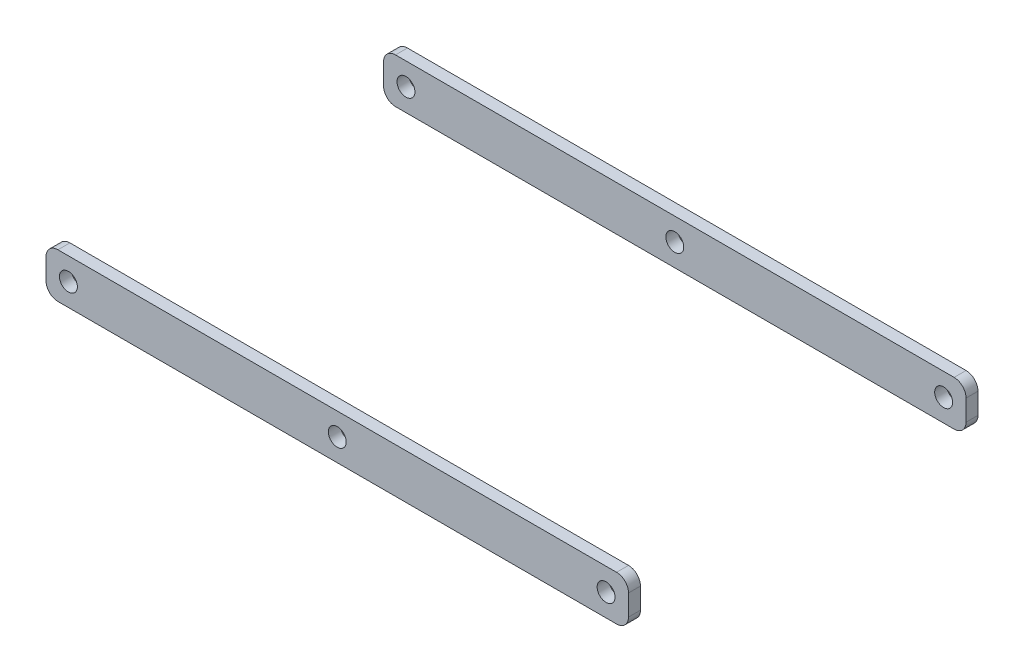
SolidWorks part; units mm, degrees
ref_plane "前视基准面" through (0, 0, 0) normal (0, 0, 1) x (1, 0, 0)
ref_plane "上视基准面" through (0, 0, 0) normal (0, 1, 0) x (1, 0, 0)
ref_plane "右视基准面" through (0, 0, 0) normal (1, 0, 0) x (0, 0, -1)
other "Configuration Table"
sketch "草图1" plane through (0, 0, 0) normal (0, 0, 1) x (1, 0, 0)
  line L1 (-195, -15) -> (195, -15)
  line L2 (-195, -15) -> (-195, 15)
  line L3 (-195, 15) -> (195, 15)
  line L4 (195, -15) -> (195, 15)
  line L5 (-195, -15) -> (195, 15) construction
  line L6 (-195, 15) -> (195, -15) construction
  point P0 (0, 0)
  dimension "D1" = 195
  dimension "D2" = 15
extrude "ArmBlank_390x30" add sketch "草图1" against normal mid plane 234
sketch "草图2" plane through (0, 0, 0) normal (0, 0, 1) x (1, 0, 0)
  line L1 (-200, -20) -> (200, -20)
  line L2 (-200, -20) -> (-200, 20)
  line L3 (-200, 20) -> (200, 20)
  line L4 (200, -20) -> (200, 20)
  line L5 (-200, -20) -> (200, 20) construction
  line L6 (-200, 20) -> (200, -20) construction
  point P0 (0, 0)
  dimension "D1" = 200
  dimension "D2" = 20
extrude "Separate_Left_Right_8mm_Arms" cut sketch "草图2" against normal mid plane 218
sketch "草图3" plane through (0, 0, 0) normal (0, 0, 1) x (1, 0, 0)
  circle A0 centre (-180, 0) radius 6
  circle A1 centre (0, 0) radius 6
  circle A2 centre (180, 0) radius 6
  dimension "D1" = 12
  dimension "D2" = 180
  dimension "D3" = 180
extrude "Three_Pivot_Holes_D12_Pitch180" cut sketch "草图3" against normal mid plane 1000
fillet "Arm_End_Corner_R8" radius 8 4 edges at (195, 15, -113) (195, -15, -113) (-195, -15, -113) (-195, 15, -113)
fillet "Arm_End_Corner_R8_Body1" radius 8 4 edges at (195, 15, 113) (-195, 15, 113) (-195, -15, 113) (195, -15, 113)
